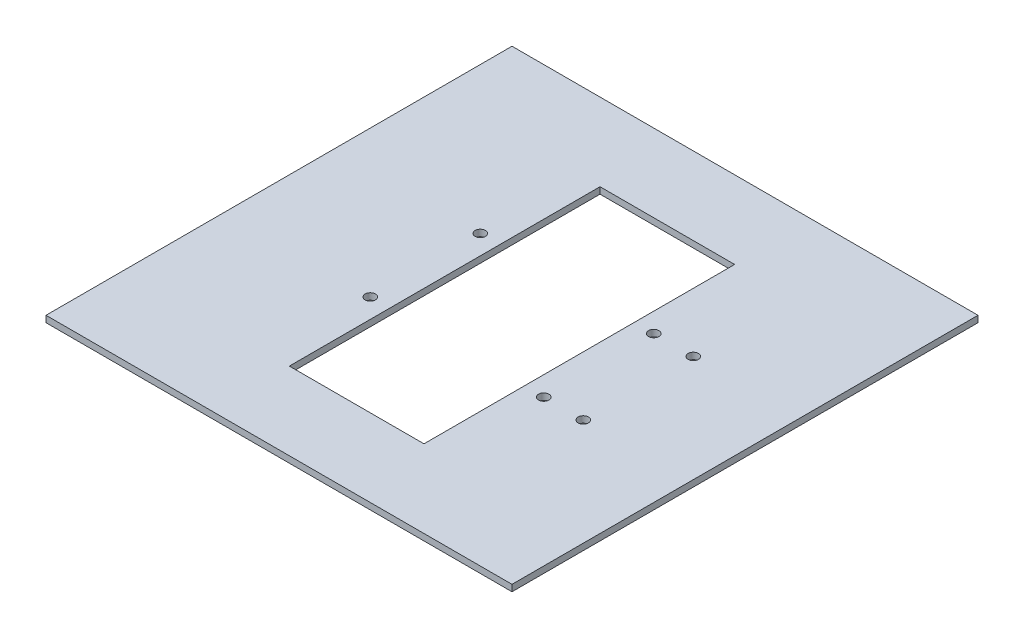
SolidWorks part; units mm, degrees
ref_plane "Front Plane" through (0, 0, 0) normal (0, 0, 1) x (1, 0, 0)
ref_plane "Top Plane" through (0, 0, 0) normal (0, 1, 0) x (1, 0, 0)
ref_plane "Right Plane" through (0, 0, 0) normal (1, 0, 0) x (0, 0, -1)
sketch "Sketch1" plane through (0, 0, 0) normal (0, 1, 0) x (1, 0, 0)
  line L1 (-114.3, 114.3) -> (114.3, 114.3)
  line L2 (-114.3, 114.3) -> (-114.3, -114.3)
  line L3 (-114.3, -114.3) -> (114.3, -114.3)
  line L4 (114.3, 114.3) -> (114.3, -114.3)
  line L5 (-114.3, 114.3) -> (114.3, -114.3) construction
  line L6 (-114.3, -114.3) -> (114.3, 114.3) construction
  point P0 (0, 0)
  dimension "D1" = 228.6
  dimension "D2" = 228.6
extrude "Boss-Extrude1" add sketch "Sketch1" along normal mid plane 3.175
sketch "Sketch2" plane through (0, 1.5875, 0) normal (0, 1, 0) x (1, 0, 0)
  line L1 (-33.02, 76.2) -> (33.02, 76.2)
  line L2 (-33.02, 76.2) -> (-33.02, -76.2)
  line L3 (-33.02, -76.2) -> (33.02, -76.2)
  line L4 (33.02, 76.2) -> (33.02, -76.2)
  line L5 (-33.02, 76.2) -> (33.02, -76.2) construction
  line L6 (-33.02, -76.2) -> (33.02, 76.2) construction
  circle A0 centre (-42.545, 26.9875) radius 2.54
  circle A1 centre (42.545, 26.9875) radius 2.54
  circle A2 centre (61.9506, 26.9875) radius 2.54
  circle A3 centre (61.9506, -26.9875) radius 2.54
  circle A4 centre (42.545, -26.9875) radius 2.54
  circle A5 centre (-42.545, -26.9875) radius 2.54
  point P13 (0, 0)
  dimension "D1" = 85.09
  dimension "D2" = 104.4956
  dimension "D3" = 53.975
  dimension "D4" = 85.09
  dimension "D5" = 104.4956
  dimension "D6" = 42.545
  dimension "D7" = 42.545
  dimension "D9" = 5.08
  dimension "D10" = 5.08
  dimension "D11" = 5.08
  dimension "D12" = 5.08
  dimension "D13" = 5.08
  dimension "D14" = 5.08
  dimension "D8" = 26.9875
  dimension "D15" = 66.04
  dimension "D16" = 152.4
extrude "Cut-Extrude1" cut sketch "Sketch2" against normal through all
